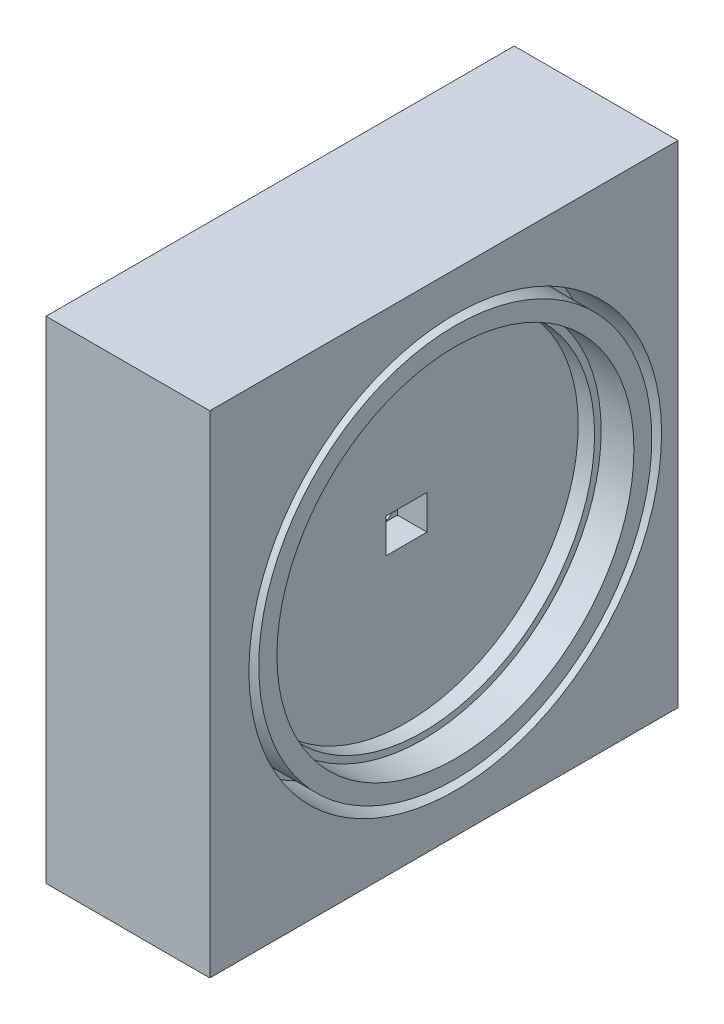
SolidWorks part; units mm, degrees
ref_plane "Front Plane" through (0, 0, 0) normal (0, 0, 1) x (1, 0, 0)
ref_plane "Top Plane" through (0, 0, 0) normal (0, 1, 0) x (1, 0, 0)
ref_plane "Right Plane" through (0, 0, 0) normal (1, 0, 0) x (0, 0, -1)
sketch "Sketch1" plane through (0, 0, 0) normal (0, 1, 0) x (1, 0, 0)
  line L2 (-20, 0) -> (-20, 150)
  line L4 (-20, 150) -> (30, 150)
  line L6 (-20, 0) -> (30, 0)
  line L7 (30, 150) -> (30, 0)
  dimension "D2" = 150
extrude "Boss-Extrude1" add sketch "Sketch1" along normal blind 250
sketch "Sketch2" plane through (30, 0, 0) normal (1, 0, 0) x (0, 0, -1)
  line L0 (75, 250) -> (75, 175) construction
  line L1 (0, 250) -> (150, 250) construction
  circle A0 centre (75, 175) radius 52.5
  dimension "D2" = 105
  dimension "D1" = 75
extrude "Cut-Extrude1" cut sketch "Sketch2" against normal blind 15 contours A0
sketch "Sketch4" plane through (0, 0, 0) normal (0, 0, 1) x (1, 0, 0)
  line L0 (30, 0) -> (30, 125) construction
  line L1 (30, 0) -> (30, 62.5)
  line L2 (30, 250) -> (30, 0) construction
  line L3 (30, 62.5) -> (-20, 62.5) construction
  line L4 (30, 0) -> (101.0377, 0)
  line L5 (-20, 250) -> (-20, 0) construction
  line L6 (-20, 0) -> (-91, 0)
  line L7 (-20, 0) -> (-20, 62.5)
  arc A0 (101.0377, 0) -> (30, 62.5) centre (101.0377, 71.6208) cw
  arc A1 (-91, 0) -> (-20, 62.5) centre (-91, 71.578) ccw
  dimension "D1" = 71.6208
  dimension "D2" = 71
extrude "Boss-Extrude2" add sketch "Sketch4" against normal up to vertex (150 mm away)
sketch "Sketch8" plane through (0, 0, -150) normal (0, 0, -1) x (-1, 0, 0)
  line L0 (-30, 250) -> (-30, 62.5)
  line L2 (20, 62.5) -> (20, 250)
  line L3 (20, 250) -> (-30, 250)
  line L4 (-101.0377, 0) -> (91, 0)
  arc A0 (-101.0377, 0) -> (-30, 62.5) centre (-101.0377, 71.6208) ccw
  arc A1 (91, 0) -> (20, 62.5) centre (91, 71.578) cw
extrude "Boss-Extrude3" add sketch "Sketch8" along normal blind 175
sketch "Sketch10" plane through (30, 0, 0) normal (1, 0, 0) x (0, 0, -1)
  line L0 (325, 250) -> (275.0118, 250)
  line L1 (0, 250) -> (325, 250) construction
  line L2 (275.0118, 250) -> (275.0118, 0)
  line L3 (325, 0) -> (0, 0) construction
  line L4 (275.0118, 0) -> (325, 0)
  line L5 (325, 0) -> (325, 250)
  dimension "D1" = 250
  dimension "D2" = 49.9882
extrude "Boss-Extrude4" add sketch "Sketch10" along normal blind 200
sketch "Sketch11" plane through (0, 0, -325) normal (0, 0, -1) x (-1, 0, 0)
  line L0 (-230, 0) -> (-230, 175) construction
  line L2 (-230, 0) -> (-230, 250) construction
  line L3 (-166.5, 175) -> (-135.5, 175)
  line L4 (-166.5, 175) -> (-197.5, 175)
  line L5 (-197.5, 175) -> (-197.5, 154)
  line L6 (-197.5, 154) -> (-135.5, 154)
  line L8 (-135.5, 154) -> (-135.5, 175)
  dimension "D1" = 175
  dimension "D2" = 31
  dimension "D3" = 31
  dimension "D4" = 63.5
  dimension "D5" = 175
  dimension "D6" = 21
extrude "Cut-Extrude4" cut sketch "Sketch11" against normal through all
sketch "Sketch12" plane through (0, 250, 0) normal (0, 1, 0) x (1, 0, 0)
  line L0 (30, 275.0118) -> (30, 325)
  line L1 (-20, 325) -> (230, 325) construction
  line L2 (30, 325) -> (230, 325)
  line L3 (230, 325) -> (230, 275.0118)
  line L4 (230, 275.0118) -> (30, 275.0118)
extrude "Cut-Extrude5" cut sketch "Sketch12" against normal blind 55
sketch "Sketch16" plane through (15, 0, 0) normal (1, 0, 0) x (0, 0, -1)
  line L0 (71.75, 180) -> (78.25, 180)
  line L2 (71.75, 170) -> (78.25, 170)
  spline S0 degree 2 poles (78.25, 170) (84.2851, 175) (78.25, 180) knots 0 0 0 1 1 1
  spline S1 degree 2 poles (71.75, 180) (66.058, 175) (71.75, 170) knots 0 0 0 1 1 1
  point P17 (75, 175)
  point P18 (75, 175)
  dimension "D1" = 6.5
  dimension "D2" = 6.5
  dimension "D3" = 10
extrude "Cut-Extrude8" cut sketch "Sketch16" against normal blind 20
sketch "Sketch17" plane through (15, 0, 0) normal (1, 0, 0) x (0, 0, -1)
  line L1 (81.3183, 180.25) -> (81.3183, 169.75)
  line L3 (68.8183, 169.75) -> (68.8183, 180.25)
  line L4 (68.8183, 169.75) -> (81.3183, 169.75)
  line L5 (68.8183, 180.25) -> (81.3183, 180.25)
  line L6 (78.25, 180) -> (71.75, 180) construction
  point P35 (69.975, 175)
  dimension "D2" = 10.5
  dimension "D3" = 12.5
  dimension "D4" = 0.25
extrude "Cut-Extrude9" cut sketch "Sketch17" against normal blind 9 contours L5 L3 L4 M3 | L5 L4 L1 M5
sketch "Sketch20" plane through (30, 0, 0) normal (1, 0, 0) x (0, 0, -1)
  circle A2 centre (75, 175) radius 54.5
  circle A3 centre (75, 175) radius 54.5
  dimension "D1" = 2
extrude "Cut-Extrude10" cut sketch "Sketch20" against normal blind 10
sketch "Sketch21" plane through (30, 0, 0) normal (1, 0, 0) x (0, 0, -1)
  line L0 (142.9431, 250) -> (142.9431, 195)
  line L1 (0, 250) -> (325, 250) construction
  line L2 (142.9431, 195) -> (325, 195)
  line L3 (325, 195) -> (325, 250) construction
  line L4 (325, 195) -> (325, 250)
  line L5 (142.9431, 250) -> (325, 250)
extrude "Cut-Extrude11" cut sketch "Sketch21" against normal through all
sketch "Sketch24" plane through (0, 0, -275.0118) normal (0, 0, 1) x (1, 0, 0)
  line L0 (158.25, 154) -> (158.25, 137.5)
  line L1 (158.25, 154) -> (174.75, 154)
  line L2 (174.75, 154) -> (174.75, 137.5)
  line L3 (174.75, 137.5) -> (158.25, 137.5)
  line L4 (197.5, 154) -> (135.5, 154) construction
  point P1 (166.5, 154)
  dimension "D1" = 16.5
  dimension "D2" = 16.5
  dimension "D3" = 8.25
  dimension "D4" = 0
extrude "Cut-Extrude13" cut sketch "Sketch24" against normal blind 50
sketch "Sketch25" plane through (0, 0, -275.0118) normal (0, 0, 1) x (1, 0, 0)
  line L0 (158.25, 131.1863) -> (174.75, 131.1863)
  line L1 (174.75, 131.1863) -> (174.75, 109.1863)
  line L2 (174.75, 109.1863) -> (158.25, 109.1863)
  line L3 (158.25, 109.1863) -> (158.25, 131.1863)
  line L4 (174.75, 137.5) -> (174.75, 154) construction
  line L5 (158.25, 137.5) -> (158.25, 86.1961) construction
  dimension "D1" = 0
  dimension "D2" = 0
  dimension "D3" = 22
extrude "Cut-Extrude14" cut sketch "Sketch25" against normal blind 50
sketch "Sketch26" plane through (0, 0, -275.0118) normal (0, 0, 1) x (1, 0, 0)
  line L0 (158.25, 137.5) -> (158.25, 131.1863)
  line L1 (174.75, 131.1863) -> (158.25, 131.1863) construction
  line L2 (158.25, 131.1863) -> (174.75, 131.1863)
  line L3 (174.75, 131.1863) -> (174.75, 137.5)
  line L4 (174.75, 137.5) -> (158.25, 137.5)
extrude "Cut-Extrude15" cut sketch "Sketch26" against normal blind 50
sketch "Sketch27" plane through (230, 0, 0) normal (1, 0, 0) x (0, 0, -1)
  line L0 (291.5012, 135.1004) -> (298.0012, 135.1004)
  line L2 (291.5012, 125.1004) -> (298.0012, 125.1004)
  spline S0 degree 2 poles (298.0012, 125.1004) (303.3445, 130.2078) (298.0012, 135.1004) knots 0 0 0 1 1 1
  spline S1 degree 2 poles (291.5012, 135.1004) (285.4561, 130.2078) (291.5012, 125.1004) knots 0 0 0 1 1 1
  point P5 (294.7512, 109.4204)
  point P17 (294.7512, 115.4204)
  point P18 (294.7512, 115.4204)
  dimension "D1" = 6.5
  dimension "D2" = 6.5
  dimension "D3" = 10
  dimension "D4" = 15.68
extrude "Cut-Extrude16" cut sketch "Sketch27" against normal blind 29 from offset 71.75
sketch "Sketch29" plane through (158.25, 0, 0) normal (1, 0, 0) x (0, 0, -1)
  line L0 (298.0012, 135.1004) -> (291.5012, 135.1004) construction
  line L1 (291.5012, 125.1004) -> (298.0012, 125.1004) construction
  line L2 (298.0012, 135.1004) -> (291.5012, 135.1004)
  line L3 (291.5012, 125.1004) -> (298.0012, 125.1004)
  line L4 (300.8323, 135.3999) -> (300.8323, 124.8999)
  line L5 (288.3323, 124.8999) -> (288.3323, 135.3999)
  line L6 (288.3323, 124.8999) -> (300.8323, 124.8999)
  line L7 (288.3323, 135.3999) -> (300.8323, 135.3999)
  parabola Q0 construction
  parabola Q1 construction
  parabola Q2
  parabola Q3
  dimension "D1" = 12.5
  dimension "D2" = 10.5
extrude "Cut-Extrude18" cut sketch "Sketch29" against normal blind 9
sketch "Sketch30" plane through (0, 0, -275.0118) normal (0, 0, 1) x (1, 0, 0)
  line L0 (158.25, 135.3999) -> (158.25, 124.8999) construction
  line L1 (158.25, 142.0296) -> (158.25, 109.1753)
  line L2 (158.25, 142.0296) -> (198.9228, 142.0296)
  line L3 (198.9228, 142.0296) -> (198.9228, 109.1753)
  line L4 (198.9228, 109.1753) -> (158.25, 109.1753)
extrude "Cut-Extrude19" cut sketch "Sketch30" against normal blind 50
sketch "Sketch31" plane through (-5, 0, 0) normal (1, 0, 0) x (0, 0, -1)
  circle A0 centre (74.9505, 175.0712) radius 3.5
  dimension "D1" = 7
extrude "Cut-Extrude20" cut sketch "Sketch31" against normal blind 20
sketch "Sketch32" plane through (0, 0, -325) normal (0, 0, -1) x (-1, 0, 0)
  line L4 (-129.25, 135.1004) -> (-149.25, 135.1004)
  line L5 (-149.25, 135.1004) -> (-149.25, 125.1004)
  line L6 (-149.25, 125.1004) -> (-129.25, 125.1004)
  line L7 (-129.25, 125.1004) -> (-129.25, 135.1004)
  line L8 (-129.25, 135.1004) -> (-149.25, 135.1004)
  line L9 (-149.25, 135.1004) -> (-149.25, 125.1004)
  line L10 (-149.25, 125.1004) -> (-129.25, 125.1004)
  line L11 (-129.25, 125.1004) -> (-129.25, 135.1004)
  circle A0 centre (-131.6164, 129.9902) radius 3.5
  dimension "D2" = 7
  dimension "D1" = 0
extrude "Cut-Extrude21" cut sketch "Sketch32" against normal blind 33 contours L11 A0
sketch "Sketch33" plane through (30, 0, 0) normal (1, 0, 0) x (0, 0, -1)
  circle A0 centre (74.9505, 175.0712) radius 60
  circle A1 centre (74.9505, 175.0712) radius 63
  dimension "D1" = 120
  dimension "D2" = 126
extrude "Cut-Extrude22" cut sketch "Sketch33" against normal blind 20
sketch "Sketch34" plane through (0, 195, 0) normal (0, 1, 0) x (1, 0, 0)
  line L0 (-91, 325) -> (230, 325)
  line L1 (230, 325) -> (230, 235)
  line L2 (230, 235) -> (-91, 235)
  line L3 (-91, 325) -> (-91, 0) construction
  line L4 (-91, 235) -> (-91, 325)
  dimension "D1" = 90
extrude "Cut-Extrude23" cut sketch "Sketch34" against normal blind 300
sketch "Sketch35" plane through (0, 250, 0) normal (0, 1, 0) x (1, 0, 0)
  line L0 (-91, 0) -> (-20, 0)
  line L1 (-20, 0) -> (-20, 235)
  line L2 (-20, 235) -> (-91, 235)
  line L3 (-91, 235) -> (-91, 0)
  line L4 (30, 0) -> (101.0377, 0)
  line L5 (101.0377, 0) -> (101.0377, 235)
  line L6 (101.0377, 235) -> (30, 235)
  line L7 (30, 235) -> (30, 0)
extrude "Cut-Extrude24" cut sketch "Sketch35" against normal through all both
sketch "Sketch36" plane through (0, 195, 0) normal (0, 1, 0) x (1, 0, 0)
  line L0 (30, 235) -> (80, 235)
  line L1 (80, 235) -> (80, 190)
  line L2 (80, 190) -> (30, 190)
  line L3 (30, 142.9431) -> (30, 235) construction
  line L4 (30, 190) -> (30, 235)
  dimension "D1" = 50
  dimension "D2" = 45
extrude "Boss-Extrude5" add sketch "Sketch36" against normal blind 40 from offset 155
sketch "Sketch38" plane through (30, 0, 0) normal (1, 0, 0) x (0, 0, -1)
  line L0 (0, 0) -> (0, 15)
  line L1 (0, 250) -> (0, 0) construction
  line L2 (0, 15) -> (110, 15)
  line L3 (110, 15) -> (110, 0)
  line L5 (110, 0) -> (0, 0)
  dimension "D1" = 110
  dimension "D2" = 110
  dimension "D3" = 15
extrude "Boss-Extrude6" add sketch "Sketch38" along normal blind 40
sketch "Sketch39" plane through (-20, 0, 0) normal (-1, 0, 0) x (0, 0, 1)
  line L0 (-110, 0) -> (-110, 15)
  line L1 (0, 0) -> (-235, 0) construction
  line L2 (-110, 15) -> (0, 15)
  line L3 (0, 250) -> (0, 0) construction
  line L4 (0, 15) -> (0, 0)
  line L5 (0, 0) -> (-110, 0)
  dimension "D1" = 110
  dimension "D2" = 15
extrude "Boss-Extrude7" add sketch "Sketch39" along normal blind 40
sketch "Sketch40" plane through (0, 15, 0) normal (0, 1, 0) x (1, 0, 0)
  line L0 (70, 0) -> (30, 0) construction
  line L1 (-60, 0) -> (-20, 0) construction
  line L2 (-60, 0) -> (-60, 110) construction
  line L3 (70, 110) -> (70, 0) construction
  circle A0 centre (-40, 85) radius 5
  circle A1 centre (-40, 25) radius 5
  circle A2 centre (50, 85) radius 5
  circle A3 centre (50, 25) radius 5
  dimension "D1" = 10
  dimension "D2" = 10
  dimension "D3" = 10
  dimension "D4" = 10
  dimension "D5" = 60
  dimension "D6" = 25
  dimension "D7" = 60
  dimension "D8" = 25
  dimension "D9" = 20
  dimension "D10" = 20
extrude "Cut-Extrude25" cut sketch "Sketch40" against normal through all both
sketch "Sketch41" plane through (0, 0, -235) normal (0, 0, -1) x (-1, 0, 0)
  line L0 (-15.075, 162.075) -> (-15.075, 141.925)
  line L1 (-15.075, 141.925) -> (5.075, 141.925)
  line L2 (5.075, 141.925) -> (5.075, 162.075)
  line L3 (5.075, 162.075) -> (-15.075, 162.075)
  line L4 (-15.075, 109.075) -> (-15.075, 88.925)
  line L5 (-15.075, 88.925) -> (5.075, 88.925)
  line L6 (5.075, 88.925) -> (5.075, 109.075)
  line L7 (5.075, 109.075) -> (-15.075, 109.075)
  line L8 (-15.075, 56.075) -> (-15.075, 35.925)
  line L9 (-15.075, 35.925) -> (5.075, 35.925)
  line L10 (5.075, 35.925) -> (5.075, 56.075)
  line L11 (5.075, 56.075) -> (-15.075, 56.075)
  line L12 (-62.075, 30.075) -> (-62.075, 9.925)
  line L13 (-62.075, 9.925) -> (-41.925, 9.925)
  line L14 (-41.925, 9.925) -> (-41.925, 30.075)
  line L15 (-41.925, 30.075) -> (-62.075, 30.075)
  line L16 (-15.075, 162.075) -> (5.075, 141.925) construction
  line L17 (5.075, 162.075) -> (-15.075, 141.925) construction
  line L18 (-15.075, 109.075) -> (5.075, 88.925) construction
  line L19 (5.075, 109.075) -> (-15.075, 88.925) construction
  line L20 (-15.075, 56.075) -> (5.075, 35.925) construction
  line L21 (5.075, 56.075) -> (-15.075, 35.925) construction
  line L22 (-62.075, 30.075) -> (-41.925, 9.925) construction
  line L23 (-41.925, 30.075) -> (-62.075, 9.925) construction
  line L24 (20, 195) -> (-30, 195) construction
  line L25 (-80, 0) -> (-80, 40) construction
  line L26 (-80, 40) -> (-30, 40) construction
  line L27 (-30, 40) -> (-30, 195) construction
  point P16 (-52, 20)
  point P17 (-5, 46)
  point P18 (-5, 99)
  point P19 (-5, 152)
  dimension "D1" = 20.15
  dimension "D2" = 20.15
  dimension "D3" = 20.15
  dimension "D4" = 20.15
  dimension "D5" = 20.15
  dimension "D6" = 20.15
  dimension "D7" = 20.15
  dimension "D8" = 20.15
  dimension "D9" = 43
  dimension "D10" = 96
  dimension "D11" = 149
  dimension "D12" = 28
  dimension "D13" = 20
  dimension "D14" = 25
  dimension "D15" = 25
  dimension "D16" = 25
extrude "Cut-Extrude26" cut sketch "Sketch41" against normal blind 31.5
sketch "Sketch42" plane through (0, 0, 0) normal (1, 0, 0) x (0, 0, -1)
  line L0 (142.9431, 195) -> (142.9431, 0)
  line L1 (142.9431, 195) -> (235, 195)
  line L2 (235, 195) -> (235, 0)
  line L3 (235, 0) -> (142.9431, 0)
extrude "Cut-Extrude27" cut sketch "Sketch42" against normal blind 50 and the other way blind 99
sketch "Sketch47" plane through (30, 0, 0) normal (1, 0, 0) x (0, 0, -1)
  line L0 (0, 250) -> (0, 15) construction
  line L1 (142.9431, 0) -> (0, 0)
  line L2 (142.9431, 0) -> (142.9431, 100)
  line L3 (142.9431, 100) -> (0, 100)
  line L4 (0, 0) -> (0, 100)
  dimension "D1" = 100
extrude "Cut-Extrude29" cut sketch "Sketch47" against normal blind 121 and the other way blind 50
sketch "Sketch48" plane through (0, 100, 0) normal (0, -1, 0) x (1, 0, 0)
  line L0 (30, 0) -> (-20, 0) construction
  line L1 (-20, -142.9431) -> (30, -142.9431) construction
  line L2 (-20, 0) -> (-20, -142.9431) construction
  line L3 (30, -142.9431) -> (30, 0) construction
  line L4 (-7.5, -83.9716) -> (17.5, -83.9716)
  line L5 (-7.5, -83.9716) -> (-7.5, -58.9716)
  line L6 (-7.5, -58.9716) -> (17.5, -58.9716)
  line L7 (17.5, -83.9716) -> (17.5, -58.9716)
  line L8 (-7.5, -83.9716) -> (17.5, -58.9716) construction
  line L9 (-7.5, -58.9716) -> (17.5, -83.9716) construction
  point P6 (5, -71.4716)
  dimension "D1" = 25
  dimension "D2" = 25
  dimension "D3" = 71.4716
  dimension "D4" = 71.4716
  dimension "D5" = 12.5
extrude "Cut-Extrude30" cut sketch "Sketch48" against normal blind 10
sketch "Sketch49" plane through (0, 0, -142.9431) normal (0, 0, -1) x (-1, 0, 0)
  line L0 (20, 250) -> (-30, 250) construction
  line L1 (20, 250) -> (20, 100) construction
  line L4 (-17.5, 162.5) -> (7.5, 162.5)
  line L5 (-17.5, 162.5) -> (-17.5, 187.5)
  line L6 (-17.5, 187.5) -> (7.5, 187.5)
  line L7 (7.5, 162.5) -> (7.5, 187.5)
  line L8 (-17.5, 162.5) -> (7.5, 187.5) construction
  line L9 (-17.5, 187.5) -> (7.5, 162.5) construction
  point P6 (-5, 175)
  dimension "D1" = 25
  dimension "D2" = 25
  dimension "D3" = 75
  dimension "D4" = 12.5
extrude "Cut-Extrude31" cut sketch "Sketch49" against normal blind 10
